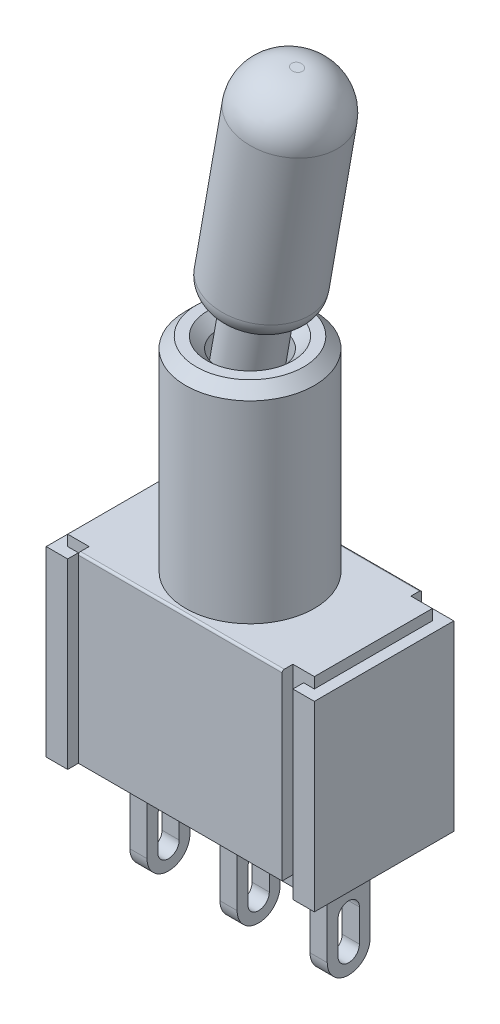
SolidWorks part; units mm, degrees
ref_plane "Plan1" through (0, 0, 0) normal (0, 0, 1) x (1, 0, 0)
ref_plane "Plan2" through (0, 0, 0) normal (0, 1, 0) x (1, 0, 0)
ref_plane "Plan3" through (0, 0, 0) normal (1, 0, 0) x (0, 0, -1)
sketch "Esquisse1" plane through (0, 0, 0) normal (0, 0, 1) x (1, 0, 0)
  line L1 (0, 0) -> (12.5, 0)
  line L2 (0, 0) -> (0, 8.5)
  line L3 (0, 8.5) -> (12.5, 8.5)
  line L4 (12.5, 0) -> (12.5, 8.5)
  dimension "D1" = 12.5
  dimension "D2" = 8.5
extrude "Base-Extrusion" add sketch "Esquisse1" along normal mid plane 6.5
sketch "Esquisse2" plane through (0, 0, 3.25) normal (0, 0, 1) x (1, 0, 0)
  line L0 (12.5, 8.5) -> (0, 8.5) construction
  line L1 (1, 8.5) -> (11.5, 8.5)
  line L2 (1, 8.5) -> (1, 0)
  line L3 (1, 0) -> (11.5, 0)
  line L4 (11.5, 8.5) -> (11.5, 0)
  line L5 (0, 8.5) -> (0, 0) construction
  line L6 (12.5, 0) -> (12.5, 8.5) construction
  dimension "D1" = 1
  dimension "D2" = 1
extrude "Enlèv. mat.-Extru.1" cut sketch "Esquisse2" against normal blind 0.5
sketch "Esquisse5" plane through (0, 0, 0) normal (0, -1, 0) x (1, 0, 0)
  line L0 (2.9, 2.75) -> (4.15, 0.25)
  line L1 (1, 2.75) -> (11.5, 2.75) construction
  line L2 (4.15, 0.25) -> (5.4, 2.75)
  line L3 (2.9, 2.75) -> (5.4, 2.75)
  line L4 (7.1, 2.75) -> (9.6, 2.75)
  line L5 (6.25, 4.7751) -> (6.25, -5.4401) construction
  line L6 (0, 3.25) -> (0, -3.25) construction
  line L7 (8.35, 0.25) -> (7.1, 2.75)
  line L8 (4.15, 4.7751) -> (4.15, -3.9414) construction
  line L9 (9.6, 2.75) -> (8.35, 0.25)
  dimension "D1" = 6.25
  dimension "D2" = 2.1
  dimension "D3" = 2.5
  dimension "D4" = 2.5
  dimension "D5" = 1.25
extrude "Enlèv. mat.-Extru.2" cut sketch "Esquisse5" against normal blind 1
ref_plane "Plan4" through (6.25, 0, 0) normal (1, 0, 0) x (0, 0, -1)
sketch "Esquisse4" plane through (6.25, 0, 0) normal (1, 0, 0) x (0, 0, -1)
  line L0 (1.5, 0) -> (-1.5, 0)
  line L1 (1.5, 0) -> (1.5, -1)
  line L2 (-1.5, 0) -> (-1.5, -1)
  line L3 (1.5, -1) -> (1, -1)
  line L4 (-1.5, -1) -> (-1, -1)
  line L5 (1, -1) -> (1, -4)
  line L6 (-1, -1) -> (-1, -4)
  line L7 (0.5, -2.5) -> (0.5, -4)
  line L8 (-0.5, -2.5) -> (-0.5, -4)
  arc A0 (1, -4) -> (-1, -4) centre (0, -4) cw
  arc A1 (-0.5, -4) -> (0.5, -4) centre (0, -4) ccw
  arc A2 (0.5, -2.5) -> (-0.5, -2.5) centre (0, -2.5) ccw
  dimension "D8" = 1
  dimension "D9" = 1
  dimension "D10" = 1.5
  dimension "D1" = 1.5
  dimension "D2" = 3
  dimension "D3" = 3
  dimension "D4" = 3
  dimension "D5" = 1
  dimension "D6" = 0.5
  dimension "D7" = 2
extrude "Boss.-Extru.1" add sketch "Esquisse4" along normal mid plane 0.8
pattern_linear "Répétition linéaire1" count 2 spacing 4.2 along (1, 0, 0) count 2 spacing 4.2 along (-1, 0, 0) of "Boss.-Extru.1"
mirror "Symétrie1" about plane through (0, 0, 0) normal (0, 0, 1) of "Enlèv. mat.-Extru.2", "Enlèv. mat.-Extru.1"
sketch "Esquisse7" plane through (0, 0, 2.75) normal (0, 0, 1) x (1, 0, 0)
  line L0 (11.5, 8.5) -> (1, 8.5) construction
  line L1 (1.5, 8.5) -> (11, 8.5)
  line L2 (1.5, 8.5) -> (1.5, 1)
  line L3 (1.5, 1) -> (11, 1)
  line L4 (11, 8.5) -> (11, 1)
  line L5 (1, 8.5) -> (1, 0) construction
  line L6 (11.5, 0) -> (11.5, 8.5) construction
  dimension "D1" = 0.5
  dimension "D2" = 0.5
  dimension "D3" = 7.5
extrude "Boss.-Extru.2" add sketch "Esquisse7" along normal blind 0.5
sketch "Esquisse9" plane through (0, 1, 0) normal (0, -1, 0) x (1, 0, 0)
  line L0 (1.5, 3.25) -> (1.5, 2.75)
  line L1 (1.5, 3.25) -> (11, 3.25)
  line L2 (11, 3.25) -> (11, 2.75)
  line L3 (11, 2.75) -> (9.3205, 2.75)
  line L4 (1.5, 2.75) -> (3.1795, 2.75)
  line L5 (5.1205, 2.75) -> (7.3795, 2.75)
  line L37 (3.1795, 2.75) -> (4.15, 0.809)
  line L38 (5.1205, 2.75) -> (4.15, 0.809)
  line L40 (7.3795, 2.75) -> (8.35, 0.809)
  line L41 (9.3205, 2.75) -> (8.35, 0.809)
  line L42 (2.9, 2.75) -> (4.15, 0.25) construction
  line L43 (4.15, 0.25) -> (5.4, 2.75) construction
  line L44 (7.1, 2.75) -> (8.35, 0.25) construction
  line L45 (8.35, 0.25) -> (9.6, 2.75) construction
  dimension "D1" = 0.25
  dimension "D2" = 0.25
  dimension "D3" = 0.25
  dimension "D4" = 0.25
extrude "Boss.-Extru.3" add sketch "Esquisse9" along normal blind 0.5
mirror "Symétrie2" about plane through (0, 0, 0) normal (0, 0, 1) of "Boss.-Extru.3", "Boss.-Extru.2"
sketch "Esquisse10" plane through (0, 8.5, 0) normal (0, 1, 0) x (-1, 0, 0)
  line L0 (-1.5, -3.25) -> (-1.5, -2.75)
  line L1 (-1.5, -2.75) -> (-0.5, -2.75)
  line L2 (-1.5, -3.25) -> (-11, -3.25)
  line L3 (-11, -3.25) -> (-11, -2.75)
  line L4 (-11, -2.75) -> (-12, -2.75)
  line L5 (-1.5, 2.75) -> (-0.5, 2.75)
  line L6 (-1.5, 2.75) -> (-1.5, 3.25)
  line L7 (-1.5, 3.25) -> (-11, 3.25)
  line L8 (-11, 3.25) -> (-11, 2.75)
  line L9 (-11, 2.75) -> (-12, 2.75)
  line L10 (-0.5, -2.75) -> (-0.5, 2.75)
  line L11 (-12, -2.75) -> (-12, 2.75)
  line L12 (-12.5, 3.25) -> (-12.5, -3.25) construction
  line L13 (0, 3.25) -> (0, -3.25) construction
  dimension "D1" = 0.5
  dimension "D2" = 0.5
extrude "Boss.-Extru.4" add sketch "Esquisse10" along normal blind 0.5
sketch "Esquisse11" plane through (0, 9, 0) normal (0, 1, 0) x (-1, 0, 0)
  line L1 (-6.25, 50) -> (-6.25, -50) construction
  line L2 (-11, -3.25) -> (-1.5, -3.25) construction
  circle A0 centre (-6.25, 0) radius 3
  dimension "D1" = 6
  dimension "D2" = 3.25
extrude "Boss.-Extru.5" add sketch "Esquisse11" along normal blind 9.5
sketch "Esquisse12" plane through (0, 18.5, 0) normal (0, 1, 0) x (-1, 0, 0)
  line L0 (-6.65, 0) -> (-5.85, 0) construction
  circle A0 centre (-6.25, 0) radius 1.5
  dimension "D1" = 3
extrude "Enlèv. mat.-Extru.3" cut sketch "Esquisse12" against normal blind 4
chamfer "Chanfrein1" distance 0.5 angle 45 2 edges at (6.25, 18.5, 3) (6.25, 18.5, 1.5)
ref_plane "Plan5" through (0, 16, 0) normal (0, 1, 0) x (-1, 0, 0)
ref_plane "Plan7" through (1.9009, 10.7807, 0) normal (0.1736, 0.9848, 0) x (-0.9848, 0.1736, 0)
sketch "Esquisse14" plane through (1.9009, 10.7807, 0) normal (0.1736, 0.9848, 0) x (-0.9848, 0.1736, 0)
  circle A0 centre (-3.0294, 0) radius 1.25
  ellipse E0 centre (-3.0294, 0) end of major axis (-3.0294, 3) minor radius 2.9544 construction
  dimension "D1" = 2.5
extrude "Boss.-Extru.6" add sketch "Esquisse14" along normal blind 10
sketch "Esquisse15" plane through (3.6374, 20.6288, 0) normal (0.1736, 0.9848, 0) x (-0.9848, 0.1736, 0)
  circle A0 centre (-3.0294, 0) radius 2.25
  circle A1 centre (-3.0294, 0) radius 1.25 construction
  dimension "D1" = 4.5
extrude "Boss.-Extru.7" add sketch "Esquisse15" along normal blind 10.5
fillet "Congé1" radius 1 1 edges at (4.405, 20.4935, 0)
fillet "Congé2" radius 2 1 edges at (6.2283, 30.834, 0)
fillet "Congé3" radius 0.1 2 edges at (6.25, 9, -3.25) (6.25, 9, 3.25)
